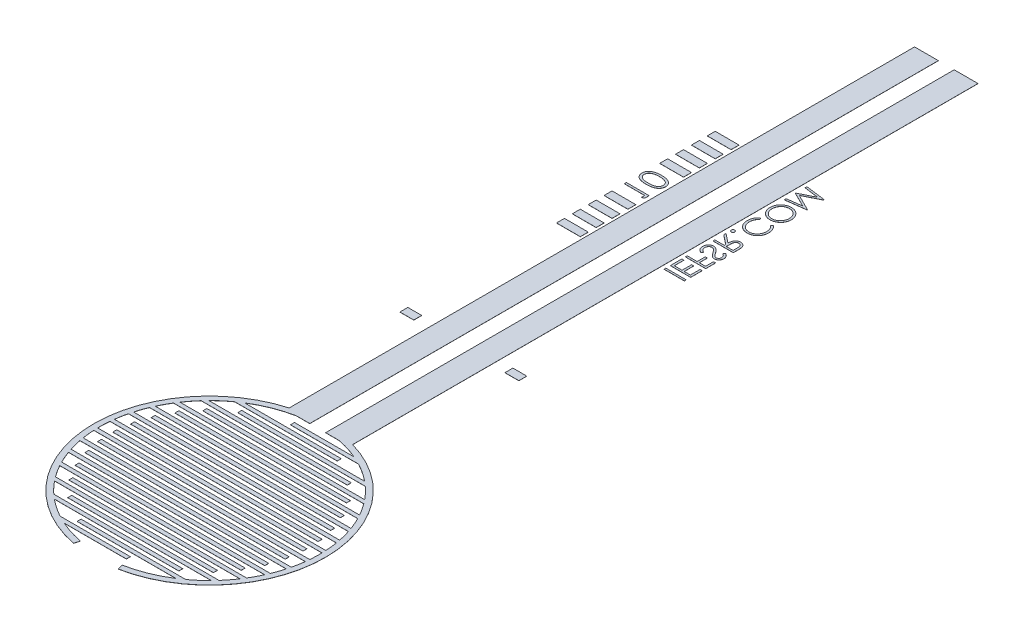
SolidWorks part; units mm, degrees
ref_plane "Front" through (0, 0, 0) normal (0, 0, 1) x (1, 0, 0)
ref_plane "Top" through (0, 0, 0) normal (0, 1, 0) x (1, 0, 0)
ref_plane "Right" through (0, 0, 0) normal (1, 0, 0) x (0, 0, -1)
sketch "Sketch1"
extrude "Extrude1" add sketch "Sketch1" along normal blind 0.007
